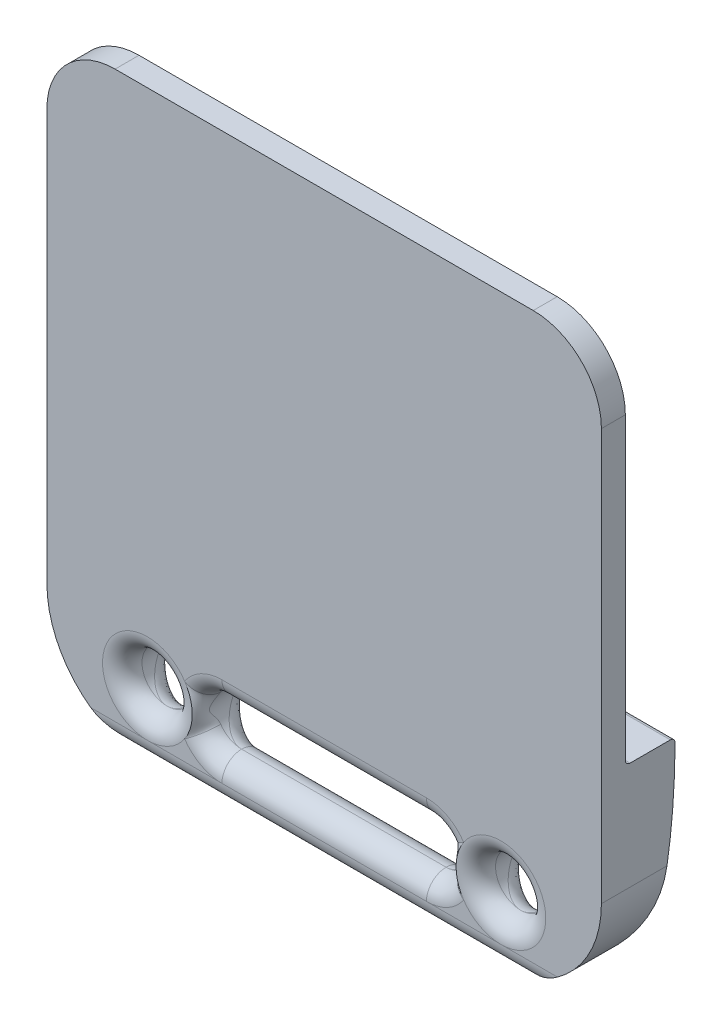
SolidWorks part; units mm, degrees
ref_plane "Front Plane" through (0, 0, 0) normal (0, 0, 1) x (1, 0, 0)
ref_plane "Top Plane" through (0, 0, 0) normal (0, 1, 0) x (1, 0, 0)
ref_plane "Right Plane" through (0, 0, 0) normal (1, 0, 0) x (0, 0, -1)
sketch "Sketch1" plane through (0, 0, 0) normal (0, 0, 1) x (1, 0, 0)
  line L1 (-115.8875, 0) -> (115.8875, 0)
  line L2 (-115.8875, 0) -> (-115.8875, 127.075)
  line L3 (-87.3875, 155.575) -> (87.3875, 155.575)
  line L4 (115.8875, 0) -> (115.8875, 127.075)
  arc A0 (87.3875, 155.575) -> (115.8875, 127.075) centre (87.3875, 127.075) cw
  arc A1 (-115.8875, 127.075) -> (-87.3875, 155.575) centre (-87.3875, 127.075) cw
  point P4 (0, 0)
  point P7 (115.8875, 155.575)
  dimension "D3" = 28.5
  dimension "D1" = 231.775
  dimension "D2" = 155.575
extrude "Extrude1" add sketch "Sketch1" against normal blind 10
sketch "Sketch4" plane through (0, 0, 0) normal (0, 0, 1) x (1, 0, 0)
  line L0 (-115.8875, 0) -> (115.8875, 0)
  line L1 (-115.8875, 0) -> (-115.8875, -44.9)
  line L2 (115.8875, 0) -> (115.8875, -44.9)
  line L3 (-71.8875, -88.9) -> (71.8875, -88.9)
  line L4 (-115.8875, 0) -> (115.8875, 0) construction
  arc A0 (115.8875, -44.9) -> (71.8875, -88.9) centre (71.8875, -44.9) cw
  arc A1 (-115.8875, -44.9) -> (-71.8875, -88.9) centre (-71.8875, -44.9) ccw
  dimension "D2" = 44
  dimension "D1" = 88.9
extrude "Extrude2" add sketch "Sketch4" against normal blind 30.8
sketch "Sketch5" plane through (0, 0, 0) normal (1, 0, 0) x (0, 0, -1)
  line L0 (0, 0) -> (0, -88.9) construction
  line L1 (0, -88.9) -> (35.8018, -88.9) construction
  line L2 (8.25, -88.9) -> (8.25, -90.1221)
  line L3 (8.25, -90.1221) -> (-2.5002, -90.1221)
  line L4 (-2.5002, -90.1221) -> (-2.5002, -80.65)
  line L5 (-2.5002, -80.65) -> (0, -80.65)
  line L6 (0, 0) -> (30.8, 0) construction
  line L7 (30.8, 0) -> (30.8, -88.9)
  line L8 (30.8, -88.9) -> (8.25, -88.9)
  circle A0 centre (8.25, -80.65) radius 8.25
  arc A1 (15.7126, -84.1675) -> (8.25, -88.9) centre (8.25, -80.65) cw
  spline S0 degree 2 poles (15.7126, -84.1675) (30.8, -52.1584) (30.8, 0) knots 0 0 0 1 1 1
  point P0 (0, 0)
  point P10 (15.7126, -84.1675)
  dimension "D1" = 16.5
sketch "Sketch10" plane through (115.8875, 0, 0) normal (1, 0, 0) x (0, 0, -1)
  line L0 (30.8, -88.9) -> (8.25, -88.9) construction
  line L1 (30.8, 0) -> (30.8, -88.9) construction
  line L2 (30.8, -88.9) -> (8.25, -88.9)
  line L3 (30.8, 0) -> (30.8, -88.9)
  arc A0 (15.7126, -84.1675) -> (8.25, -88.9) centre (8.25, -80.65) cw
  parabola Q0 construction
  parabola Q1
extrude "Extrude20" cut sketch "Sketch10" against normal through all
sketch "Sketch11" plane through (115.8875, 0, 0) normal (1, 0, 0) x (0, 0, -1)
  line L0 (-2.5002, -80.65) -> (0, -80.65) construction
  line L1 (-2.5002, -90.1221) -> (-2.5002, -80.65) construction
  line L2 (8.25, -88.9) -> (8.25, -90.1221) construction
  line L3 (8.25, -90.1221) -> (-2.5002, -90.1221) construction
  line L4 (-2.5002, -80.65) -> (0, -80.65)
  line L5 (-2.5002, -90.1221) -> (-2.5002, -80.65)
  line L6 (8.25, -88.9) -> (8.25, -90.1221)
  line L7 (8.25, -90.1221) -> (-2.5002, -90.1221)
  arc A0 (0, -80.65) -> (8.25, -88.9) centre (8.25, -80.65) ccw
sketch "Sketch12" plane through (115.8875, 0, 0) normal (1, 0, 0) x (0, 0, -1)
extrude "Extrude22" cut sketch "Sketch11" against normal through all
sketch "Sketch13" plane through (0, 0, 0) normal (0, 0, 1) x (1, 0, 0)
  line L0 (0, -88.9) -> (0, -72.4) construction
  line L1 (0, -88.9) -> (0, -72.4)
  line L2 (0, -72.4) -> (0, -51.4) construction
  line L3 (0, -84.1675) -> (0, 0) construction
  line L4 (125.7269, -61.9) -> (-125.7269, -61.9) construction
  line L5 (-115.8875, 0) -> (-115.8875, -44.9) construction
  line L6 (42.7375, -51.4) -> (-42.7375, -51.4)
  line L7 (42.7375, -72.4) -> (-42.7375, -72.4)
  circle A0 centre (-73.8875, -61.9) radius 10.5
  circle A1 centre (-42.7375, -61.9) radius 10.5
  circle A2 centre (42.7375, -61.9) radius 10.5
  circle A3 centre (73.8875, -61.9) radius 10.5
  point P7 (-73.8875, -61.9)
  point P14 (-53.2375, -61.9)
  point P15 (-63.3875, -61.9)
  point P19 (0, -61.9)
  point P25 (63.3875, -61.9)
  point P26 (53.2375, -61.9)
  dimension "D3" = 21
  dimension "D4" = 21
  dimension "D5" = 10.15
  dimension "D2" = 42
extrude "Extrude24" cut sketch "Sketch13" against normal through all contours L7 A2 L6 A1 | A1 | A0 | A3
fillet "Fillet2" radius 8.25 2 edges at (63.6894, -59.4004, -24.3985) (-84.1128, -64.2859, -23.0869)
fillet "Fillet3" radius 8.25 2 edges at (-63.3875, -61.9, 0) (63.3875, -61.9, 0)
fillet "Fillet4" radius 8.25 8 edges at (53.2375, -61.9, 0) (0, -72.4, 0) (-53.2375, -61.9, 0) (53.1935, -62.8606, -23.4868) (0, -72.4, -20.5126) (-53.1935, -62.8606, -23.4868) (0, -51.4, 0) (0, -51.4, -26.2116)
sketch "Sketch14" plane through (0, 0, 0) normal (1, 0, 0) x (0, 0, -1)
  line L2 (30.8, 0) -> (30.8, -30.3)
  line L3 (30.8, 0) -> (30.8, -88.9) construction
  line L4 (10, 0) -> (10, -22.225)
  line L5 (10, -22.225) -> (30.8, -30.3)
  line L6 (10, 0) -> (30.8, 0)
  point P2 (10, 0)
  dimension "D1" = 30.3
  dimension "D2" = 22.225
extrude "Extrude25" cut sketch "Sketch14" against normal mid plane 42.75
fillet "Fillet5" radius 2 4 edges
sketch "Sketch16" plane through (-21.375, 0, 0) normal (1, 0, 0) x (0, 0, -1)
  circle A1 centre (20.25, -13.532) radius 5
extrude "Extrude26" add sketch "Sketch16" along normal blind 0.5
mirror "Mirror1" about plane through (0, 0, 0) normal (1, 0, 0) of "Extrude26"
